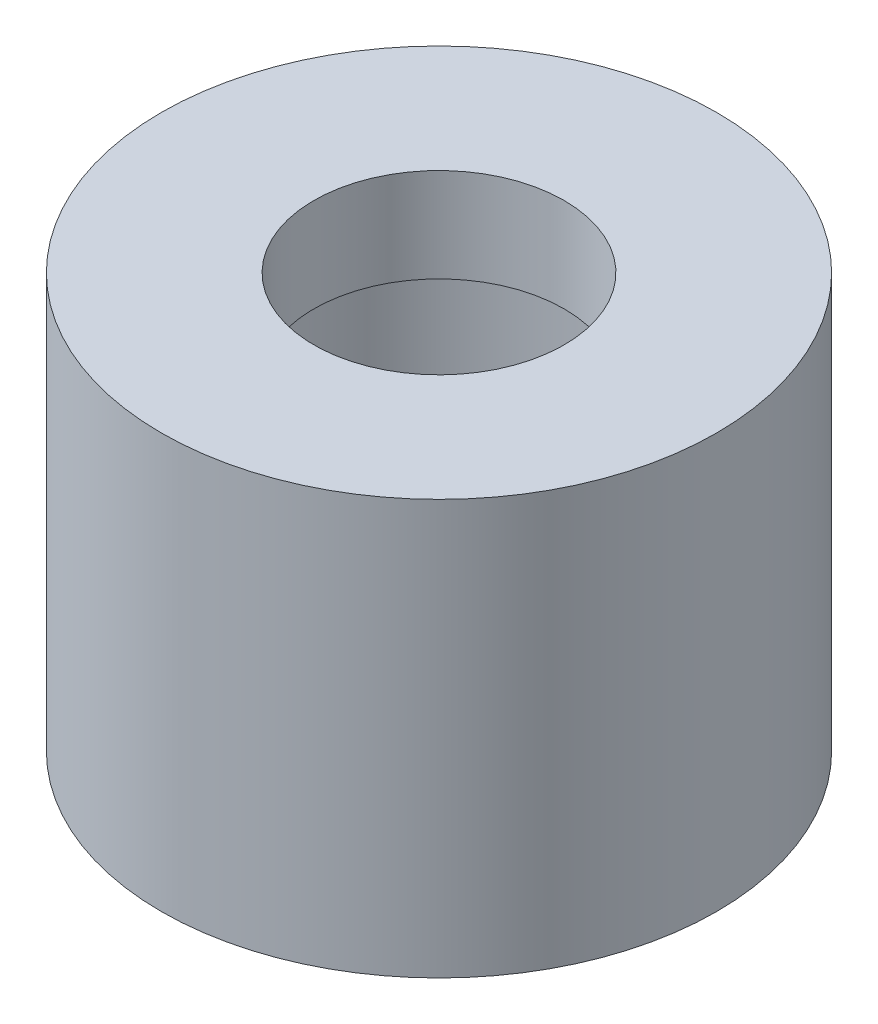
SolidWorks part; units mm, degrees
ref_plane "Front Plane" through (0, 0, 0) normal (0, 0, 1) x (1, 0, 0)
ref_plane "Top Plane" through (0, 0, 0) normal (0, 1, 0) x (1, 0, 0)
ref_plane "Right Plane" through (0, 0, 0) normal (1, 0, 0) x (0, 0, -1)
sketch "Sketch1" plane through (0, 0, 0) normal (0, 0, 1) x (1, 0, 0)
  line L0 (0, 0) -> (0, 27.31) construction
  line L1 (-9.017, 0) -> (-5.715, 0)
  line L2 (-5.715, 0) -> (-5.715, 10.414)
  line L3 (-5.715, 10.414) -> (-4.064, 10.414)
  line L4 (-4.064, 10.414) -> (-4.064, 13.462)
  line L5 (-4.064, 13.462) -> (-9.017, 13.462)
  line L6 (-9.017, 13.462) -> (-9.017, 0)
  dimension "D1" = 13.462
  dimension "D2" = 8.128
  dimension "D3" = 11.43
  dimension "D4" = 18.034
  dimension "D5" = 10.414
revolve "Revolve1" add sketch "Sketch1" angle 360 about L0
